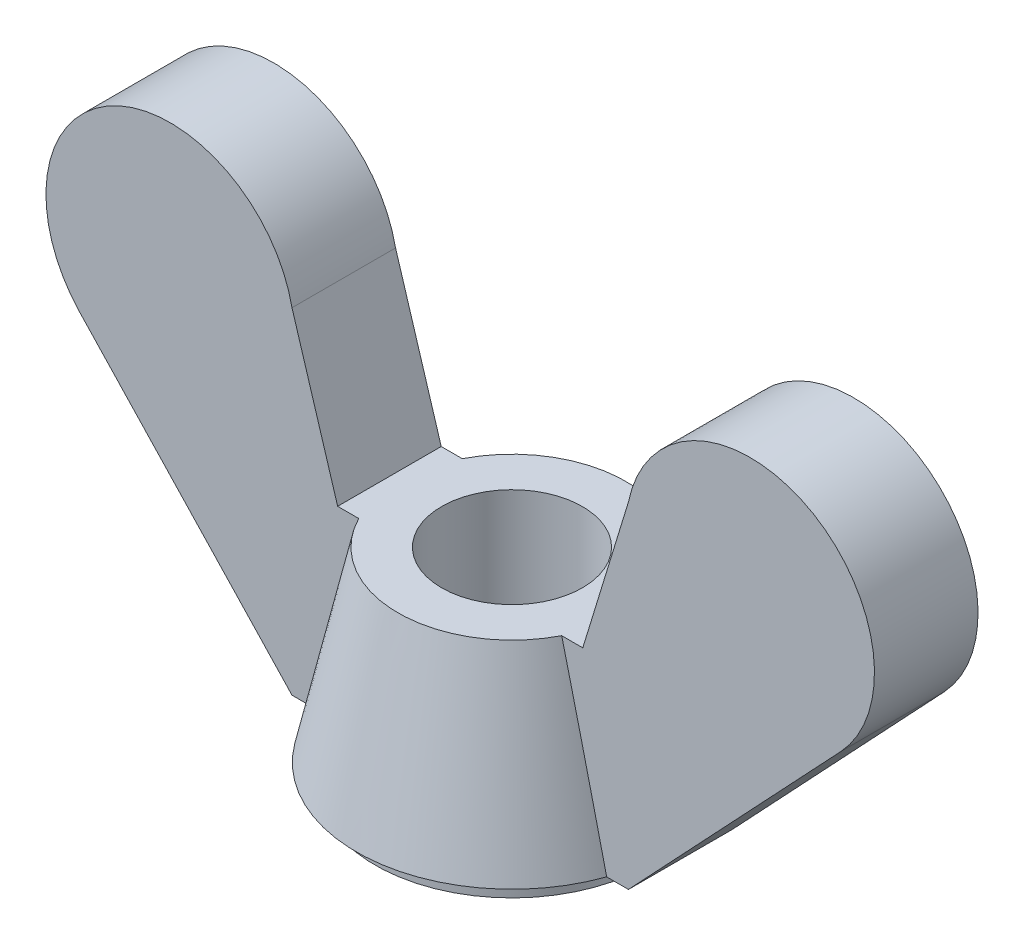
SolidWorks part; units mm, degrees
ref_plane "Plan de face" through (0, 0, 0) normal (0, 0, 1) x (1, 0, 0)
ref_plane "Plan de dessus" through (0, 0, 0) normal (0, 1, 0) x (1, 0, 0)
ref_plane "Plan de droite" through (0, 0, 0) normal (1, 0, 0) x (0, 0, -1)
sketch "Esquisse1" plane through (0, 0, 0) normal (0, 0, 1) x (1, 0, 0)
  line L0 (0, 0) -> (0, 20.6635) construction
  line L1 (0, 0) -> (0, 10)
  line L2 (0, 10) -> (5.5, 10)
  line L3 (5.5, 10) -> (7.5, 1)
  line L4 (0, 0) -> (6.6, 0)
  line L5 (6.6, 0) -> (6.6, 1)
  line L6 (6.6, 1) -> (7.5, 1)
  dimension "D1" = 11
  dimension "D2" = 15
  dimension "D3" = 13.2
  dimension "D4" = 1
  dimension "D5" = 9
revolve "Révolution1" add sketch "Esquisse1" angle 360 about L0
hole_wizard "Trou taraudé M81" positions "Esquisse3" profile "Esquisse2" tap size "M8" standard "ISO"
sketch "Esquisse3" plane through (0, 10, 0) normal (0, 1, 0) x (1, 0, 0)
  point P0 (0, 0)
sketch "Esquisse2" plane through (0, 10, 0) normal (1, 0, 0) x (0, 0, 1)
  line L0 (0, 0) -> (0, 10)
  line L1 (0, 10) -> (3.4, 10)
  line L2 (3.4, 10) -> (3.4, 0)
  line L5 (3.4, 0) -> (0, 0)
  line L11 (0, -6.35) -> (0, 107.95) construction
  dimension "Diamètre du trou pour taraudage jusqu'au prochain" = 6.8
  dimension "Profondeur du trou pour taraudage jusqu'au prochain" = 10
sketch "Esquisse4" plane through (0, 0, 0) normal (0, 0, 1) x (1, 0, 0)
  line L0 (5.5, 10) -> (-5.5, 10) construction
  line L2 (-6.6, 1) -> (6.6, 1) construction
  line L3 (-5.5108, 1) -> (-4.8495, 10)
  line L4 (-4.8495, 10) -> (-5.9171, 10)
  line L6 (-5.9171, 10) -> (-8.1213, 17.2004)
  line L7 (-5.5108, 1) -> (-8.1213, 1)
  line L8 (-8.1213, 1) -> (-18.3691, 11.8877)
  arc A0 (-8.1213, 17.2004) -> (-18.3691, 11.8877) centre (-14, 16) ccw
  dimension "D1" = 12
  dimension "D2" = 9
  dimension "D3" = 6
  dimension "D4" = 14
extrude "Boss.-Extru.1" add sketch "Esquisse4" along normal mid plane 5
mirror "Symétrie1" about plane through (0, 0, 0) normal (1, 0, 0) of "Boss.-Extru.1"
